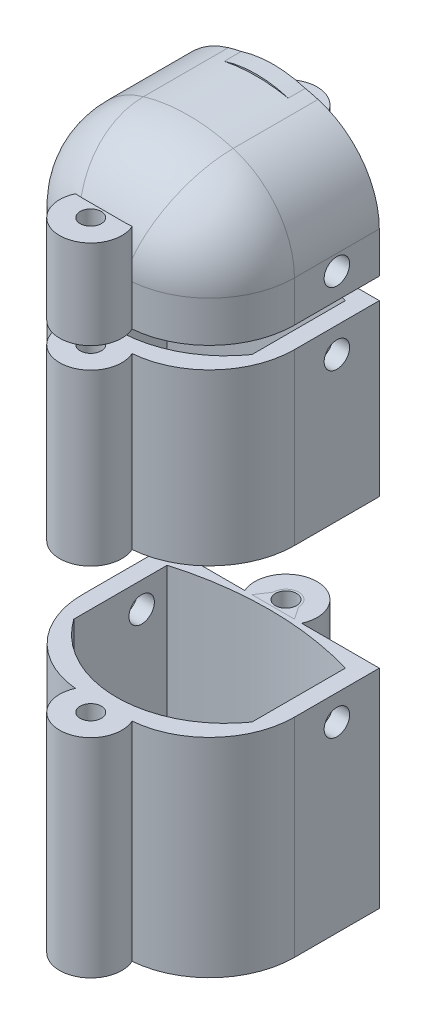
SolidWorks part; units mm, degrees
ref_plane "Alzado" through (0, 0, 0) normal (0, 0, 1) x (1, 0, 0)
ref_plane "Planta" through (0, 0, 0) normal (0, 1, 0) x (1, 0, 0)
ref_plane "Vista lateral" through (0, 0, 0) normal (1, 0, 0) x (0, 0, -1)
sketch "Croquis1" plane through (0, 0, 0) normal (0, 0, 1) x (1, 0, 0)
  line L1 (-18.6681, -47.5) -> (6.3319, -47.5)
  line L2 (-18.6681, -47.5) -> (-18.6681, 42.5)
  line L4 (6.3319, -47.5) -> (6.3319, 42.5)
  arc A0 (-18.6681, 42.5) -> (6.3319, 42.5) centre (-6.1681, 28.2195) cw
  point P0 (-2.2125, 0)
  dimension "D1" = 90
  dimension "D2" = 25
  dimension "D3" = 90
extrude "Saliente-Extruir1" add sketch "Croquis1" along normal blind 20
fillet "Redondeo1" radius 10 2 edges at (-18.6681, 42.5, 10) (6.3319, 42.5, 10)
fillet "Redondeo2" radius 10 5 edges at (-18.6681, -5.3285, 20) (-16.6633, 42.8494, 20) (-6.1681, 47.198, 20) (4.327, 42.8494, 20) (6.3319, -5.3285, 20)
sketch "Croquis2" plane through (0, 0, 20) normal (0, 0, 1) x (1, 0, 0)
  line L0 (-18.6681, 32.0235) -> (6.3319, 32.0235)
  line L4 (6.3319, 36.8429) -> (6.3319, -47.5) construction
  line L5 (-18.6681, -47.5) -> (-18.6681, 36.8429) construction
  line L7 (6.3319, 32.0235) -> (6.3319, 29.5235)
  line L8 (6.3319, 29.5235) -> (-18.6681, 29.5235)
  line L9 (-18.6681, 32.0235) -> (-18.6681, 29.5235)
  line L13 (6.3319, -5.4765) -> (-18.6681, -5.4765)
  line L14 (6.3319, -5.4765) -> (6.3319, -7.9765)
  line L15 (6.3319, -7.9765) -> (-18.6681, -7.9765)
  line L16 (-18.6681, -5.4765) -> (-18.6681, -7.9765)
  dimension "D2" = 2.5
  dimension "D4" = 2.5
extrude "Cortar-Extruir1" cut sketch "Croquis2" against normal blind 20
sketch "Croquis4" plane through (0, 0, 0) normal (0, 0, -1) x (-1, 0, 0)
  line L0 (18.6681, -47.5) -> (-6.3319, -47.5) construction
  line L2 (-4.3319, 37.5) -> (-4.3319, -47.5)
  line L3 (-4.3319, -47.5) -> (16.6681, -47.5)
  line L4 (16.6681, 32.5) -> (16.6681, -47.5)
  line L5 (-6.3319, -5.4765) -> (-6.3319, 29.5235) construction
  line L6 (18.6681, 29.5235) -> (18.6681, -5.4765) construction
  arc A0 (-4.3319, 37.5) -> (16.6681, 32.5) centre (6.1681, 35) cw
  dimension "D1" = 2
  dimension "D2" = 2
  dimension "D3" = 80
extrude "Cortar-Extruir2" cut sketch "Croquis4" against normal blind 13
sketch "Croquis6" plane through (0, -47.5, 0) normal (0, -1, 0) x (1, 0, 0)
  line L0 (-8.6681, 20) -> (-3.6681, 20) construction
  line L1 (-7.6681, 21.5) -> (-8.6681, 20)
  line L2 (-4.6681, 21.5) -> (-3.6681, 20)
  line L3 (-3.6681, 20) -> (-8.6681, 20)
  line L8 (-3.6681, 0) -> (-8.6681, 0)
  line L9 (-4.6681, -1.5) -> (-3.6681, 0)
  line L10 (-7.6681, -1.5) -> (-8.6681, 0)
  arc A0 (-4.6681, 21.5) -> (-7.6681, 21.5) centre (-6.1681, 21.5) ccw
  arc A1 (6.3319, 10) -> (-3.6681, 20) centre (-3.6681, 10) ccw construction
  arc A2 (-4.6681, -1.5) -> (-7.6681, -1.5) centre (-6.1681, -1.5) cw
  dimension "D1" = 3
  dimension "D2" = 1.5
extrude "Saliente-Extruir2" add sketch "Croquis6" against normal blind 90
sketch "Croquis7" plane through (0, -47.5, 0) normal (0, -1, 0) x (1, 0, 0)
  circle A0 centre (-6.1681, 21.5) radius 1.25
  dimension "D1" = 2.5
extrude "Cortar-Extruir3" cut sketch "Croquis7" against normal blind 90
sketch "Croquis8" plane through (0, 0, 0) normal (0, 0, -1) x (-1, 0, 0)
  line L1 (-6.3319, 32.0235) -> (18.6681, 32.0235)
  line L2 (-6.3319, 32.0235) -> (-6.3319, 29.5235)
  line L3 (-6.3319, 29.5235) -> (18.6681, 29.5235)
  line L4 (18.6681, 32.0235) -> (18.6681, 29.5235)
  line L5 (-6.3319, -5.4765) -> (18.6681, -5.4765)
  line L6 (-6.3319, -5.4765) -> (-6.3319, -7.9765)
  line L7 (-6.3319, -7.9765) -> (18.6681, -7.9765)
  line L8 (18.6681, -5.4765) -> (18.6681, -7.9765)
extrude "Cortar-Extruir5" cut sketch "Croquis8" against normal through all both and the other way through all
sketch "Croquis9" plane through (6.3319, 0, 0) normal (1, 0, 0) x (0, 0, -1)
  line L0 (-5, 35.0235) -> (-5, -47.5) construction
  line L1 (-10, -47.5) -> (0, -47.5) construction
  line L2 (0, 32.0235) -> (-10, 32.0235) construction
  line L3 (0, 29.5235) -> (-10, 29.5235) construction
  line L4 (0, -5.4765) -> (-10, -5.4765) construction
  line L5 (0, -7.9765) -> (-10, -7.9765) construction
  circle A0 centre (-5, 35.0235) radius 1.5
  circle A1 centre (-5, 26.5235) radius 1.5
  circle A2 centre (-5, -2.4765) radius 1.5
  circle A3 centre (-5, -10.9765) radius 1.5
  dimension "D1" = 3
  dimension "D3" = 3
  dimension "D5" = 3
  dimension "D7" = 3
  dimension "D2" = 3
  dimension "D4" = 3
  dimension "D6" = 3
  dimension "D8" = 3
extrude "Cortar-Extruir6" cut sketch "Croquis9" against normal blind 33
sketch "Croquis11" plane through (0, 0, 0) normal (0, 0, -1) x (-1, 0, 0)
  line L0 (-6.3319, 36.8429) -> (-6.3319, 32.0235)
  line L1 (-6.3319, 32.0235) -> (18.6681, 32.0235)
  line L3 (-6.3319, 29.5235) -> (18.6681, 29.5235)
  line L4 (18.6681, 29.5235) -> (18.6681, -5.4765)
  line L5 (18.6681, -5.4765) -> (-6.3319, -5.4765)
  line L6 (-6.3319, -5.4765) -> (-6.3319, 29.5235)
  line L7 (-6.3319, -7.9765) -> (18.6681, -7.9765)
  line L8 (18.6681, -7.9765) -> (18.6681, -47.5)
  line L9 (18.6681, -47.5) -> (-6.3319, -47.5)
  line L10 (-6.3319, -47.5) -> (-6.3319, -7.9765)
  line L11 (18.6681, 36.8429) -> (18.6681, 32.0235) construction
  line L12 (18.6681, 36.8429) -> (18.6681, 32.0235)
  arc A1 (-6.3319, 36.8429) -> (18.6681, 36.8429) centre (6.1681, 34.7133) cw
extrude "Saliente-Extruir3" add sketch "Croquis11" against normal blind 2
sketch "Croquis12" plane through (0, -47.5, 0) normal (0, -1, 0) x (1, 0, 0)
  line L0 (4.3319, 2) -> (-16.6681, 2) construction
  line L1 (-16.6681, 2) -> (4.3319, 2)
  arc A0 (-16.6681, 2) -> (4.3319, 2) centre (-6.1681, 37.7609) ccw
extrude "Cortar-Extruir7" cut sketch "Croquis12" against normal blind 90
sketch "Croquis13" plane through (0, -47.5, 0) normal (0, -1, 0) x (1, 0, 0)
  line L0 (-16.6681, 13) -> (4.3319, 13)
  arc A0 (-16.6681, 13) -> (4.3319, 13) centre (-6.1681, 5.6243) cw
extrude "Cortar-Extruir8" cut sketch "Croquis13" against normal blind 88
sketch "Croquis15" plane through (0, 42.5, 0) normal (0, 1, 0) x (1, 0, 0)
  circle A0 centre (-6.1681, 1.5) radius 1.25
  dimension "D1" = 2.5
extrude "Cortar-Extruir9" cut sketch "Croquis15" against normal blind 90
sketch "Croquis16" plane through (0, -47.5, 0) normal (0, -1, 0) x (1, 0, 0)
  circle A0 centre (-6.1681, -1.5) radius 1.25
  dimension "D1" = 2.5
extrude "Cortar-Extruir10" cut sketch "Croquis16" against normal blind 90
sketch "Croquis17" plane through (0, 0, 0) normal (0, 0, -1) x (-1, 0, 0)
  line L0 (-6.3319, -5.4765) -> (-6.3319, 29.5235) construction
  line L1 (-6.3319, 9.5235) -> (18.6681, 9.5235)
  line L2 (-6.3319, 9.5235) -> (-6.3319, -5.4765)
  line L3 (-6.3319, -5.4765) -> (18.6681, -5.4765)
  line L4 (18.6681, 9.5235) -> (18.6681, -5.4765)
  line L5 (-6.3319, -47.5) -> (-6.3319, -7.9765) construction
  line L6 (-6.3319, -32.5) -> (18.6681, -32.5)
  line L7 (-6.3319, -32.5) -> (-6.3319, -47.5)
  line L8 (-6.3319, -47.5) -> (18.6681, -47.5)
  line L9 (18.6681, -32.5) -> (18.6681, -47.5)
  line L10 (18.6681, -7.9765) -> (18.6681, -47.5) construction
  line L11 (18.6681, -47.5) -> (-6.3319, -47.5) construction
  dimension "D1" = 15
  dimension "D2" = 15
extrude "Cortar-Extruir11" cut sketch "Croquis17" against normal through all both and the other way through all
sketch "Croquis18" plane through (0, 32.0235, 0) normal (0, -1, 0) x (1, 0, 0)
  line L0 (-15.4552, 13) -> (3.119, 13) construction
  line L2 (-16.6681, 13) -> (-16.6681, 2)
  line L3 (-16.6681, 2) -> (4.3319, 2)
  line L4 (4.3319, 13) -> (4.3319, 2)
  line L5 (-14.6681, 12) -> (2.3319, 12)
  line L6 (-14.6681, 12) -> (-14.6681, 3)
  line L7 (-14.6681, 3) -> (2.3319, 3)
  line L8 (2.3319, 12) -> (2.3319, 3)
  arc A0 (-16.6681, 13) -> (4.3319, 13) centre (-6.1681, 5.6243) cw
  dimension "D1" = 2
  dimension "D2" = 2
  dimension "D3" = 1
  dimension "D4" = 1
extrude "Saliente-Extruir7" add sketch "Croquis18" against normal blind 10 separate body
sketch "Croquis19" plane through (4.3319, 0, 0) normal (1, 0, 0) x (0, 0, -1)
  circle A0 centre (-5, 35.0235) radius 1.5
extrude "Cortar-Extruir12" cut sketch "Croquis19" against normal through all both and the other way through all
sketch "Croquis20" plane through (0, 42.5, 0) normal (0, -1, 0) x (1, 0, 0)
  line L0 (-16.6681, 2) -> (4.3319, 2)
  arc A0 (-16.6681, 2) -> (4.3319, 2) centre (-6.1681, 37.7609) ccw
extrude "Saliente-Extruir8" add sketch "Croquis20" along normal blind 10.5
sketch "Croquis21" plane through (0, -32.5, 0) normal (0, -1, 0) x (1, 0, 0)
  line L0 (-9.5018, 19.9652) -> (-8.6681, 20)
  line L1 (-3.6681, 20) -> (-2.8344, 19.9652)
  line L2 (-8.6681, 20) -> (-7.6681, 21.5)
  line L3 (-4.6681, 21.5) -> (-3.6681, 20)
  line L6 (-9.5018, 0.0348) -> (-8.6681, 0)
  line L7 (-3.6681, 0) -> (-2.8344, 0.0348)
  line L8 (-4.6681, -1.5) -> (-3.6681, 0)
  line L9 (-8.6681, 0) -> (-7.6681, -1.5)
  arc A0 (-2.8344, 19.9652) -> (-9.5018, 19.9652) centre (-6.1681, 21.5) ccw
  arc A1 (-8.6681, 20) -> (-18.6681, 10) centre (-8.6681, 10) ccw construction
  arc A2 (6.3319, 10) -> (-3.6681, 20) centre (-3.6681, 10) ccw construction
  arc A3 (-7.6681, 21.5) -> (-4.6681, 21.5) centre (-6.1681, 21.5) cw
  arc A4 (-2.8344, 0.0348) -> (-9.5018, 0.0348) centre (-6.1681, -1.5) cw
  arc A5 (-7.6681, -1.5) -> (-4.6681, -1.5) centre (-6.1681, -1.5) ccw
  point P24 (-6.1681, 10)
extrude "Saliente-Extruir9" add sketch "Croquis21" against normal blind 75
sketch "Croquis22" plane through (0, 0, 0) normal (0, 0, 1) x (1, 0, 0)
  line L1 (-18.6681, 9.5235) -> (6.3319, 9.5235)
  line L2 (-18.6681, 9.5235) -> (-18.6681, -7.9765)
  line L3 (-18.6681, -7.9765) -> (6.3319, -7.9765)
  line L4 (6.3319, 9.5235) -> (6.3319, -7.9765)
  line L5 (-18.6681, 32.0235) -> (6.3319, 32.0235)
  line L6 (-18.6681, 32.0235) -> (-18.6681, 29.5235)
  line L7 (-18.6681, 29.5235) -> (6.3319, 29.5235)
  line L8 (6.3319, 32.0235) -> (6.3319, 29.5235)
extrude "Cortar-Extruir13" cut sketch "Croquis22" against normal through all both and the other way through all
